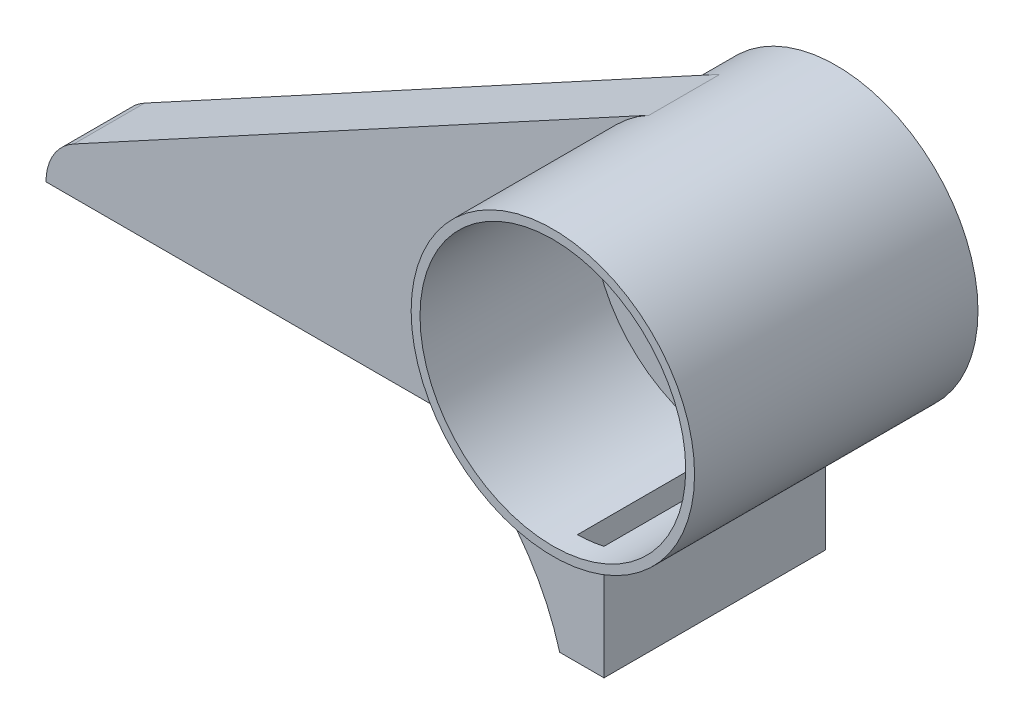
SolidWorks part; units mm, degrees
ref_plane "Front" through (0, 0, 0) normal (0, 0, 1) x (1, 0, 0)
ref_plane "Top" through (0, 0, 0) normal (0, 1, 0) x (1, 0, 0)
ref_plane "Right" through (0, 0, 0) normal (1, 0, 0) x (0, 0, -1)
sketch "Sketch1" plane through (0, 0, 0) normal (0, 1, 0) x (1, 0, 0)
  line L0 (0, 0) -> (160, 0)
  line L1 (0, 0) -> (0, 89)
  line L2 (160, 89) -> (0, 89)
  line L3 (160, 89) -> (160, 0)
  line L4 (0, 89) -> (17.1444, 89)
  dimension "D3" = 89
  dimension "D4" = 160
extrude "Base_Plate" add sketch "Sketch1" along normal blind 22
fillet "Base_Fillet" radius 20
sketch "Sketch2" plane through (0, 0, -89) normal (0, 0, -1) x (-1, 0, 0)
  line L0 (-44.5, -10) -> (44.5, -10) construction
  line L2 (-160, 22) -> (0, 22) construction
  line L3 (-160, 22) -> (0, 22)
  line L4 (-160, 22) -> (-160, 0) construction
  line L5 (-160, 22) -> (-160, 44.1629)
  line L6 (-6.2715, 32.5444) -> (-136.1758, 103.1184)
  line L8 (0, 0) -> (0, 22) construction
  arc A0 (-136.1758, 103.1184) -> (-160, 44.1629) centre (-151.4519, 75) ccw
  arc A1 (0, 22) -> (-6.2715, 32.5444) centre (-12, 22) ccw
  dimension "D1" = 64
  dimension "D4" = 12
  dimension "D3" = 151.4519
  dimension "D2" = 85
extrude "Vertical_Plate" add sketch "Sketch2" against normal blind 16
ref_plane "Circular_Plane" through (0, 0, -100) normal (0, 0, -1) x (-1, 0, 0)
sketch "Sketch3" plane through (0, 0, -100) normal (0, 0, -1) x (-1, 0, 0)
  circle A0 centre (-151.4519, 75) radius 32
  arc A1 (-136.1758, 103.1184) -> (-160, 44.1629) centre (-151.4519, 75) ccw construction
extrude "Circular_Boss" add sketch "Sketch3" against normal blind 64
sketch "Sketch4" plane through (0, 22, 0) normal (0, 1, 0) x (-1, 0, 0)
  line L1 (-119.4519, -73) -> (-160, -73) construction
  line L2 (-150, -73) -> (-150, -39)
  line L5 (-160, -73) -> (-160, -39)
  line L7 (-160, -73) -> (-150, -73)
  line L8 (-160, -39) -> (-150, -39)
  line L9 (-160, 11) -> (-160, -11) construction
  dimension "D1" = 10
  dimension "D2" = 34
extrude "Rib_Under" add sketch "Sketch4" along normal up to next
shell "Wall_Thickness" thickness 2
hole_wizard "CounterBore" positions "Sketch5" profile "Sketch6"
sketch "Sketch5" plane through (0, 22, 0) normal (0, 1, 0) x (-1, 0, 0)
  line L0 (0, -20) -> (0, -73) construction
  line L2 (-6.2715, -89) -> (-136.1758, -89) construction
  point P0 (-38, -39)
  dimension "D1" = 38
  dimension "D2" = 50
sketch "Sketch6" plane through (38, 22, -39) normal (1, 0, 0) x (0, 0, 1)
  line L0 (0, 0) -> (0, 22)
  line L1 (0, 22) -> (12, 22)
  line L2 (12, 22) -> (12, 2)
  line L3 (12, 2) -> (19, 2)
  line L4 (19, 2) -> (19, 0)
  line L5 (19, 0) -> (0, 0)
pattern_linear "LPattern1" count 2 spacing 65
fillet "Rib_Fillet" radius 55 3 edges at (150, 43.033, -56) (150, 32.5165, -73) (150, 32.5165, -39)
fillet "Circ_Fillet" radius 5
